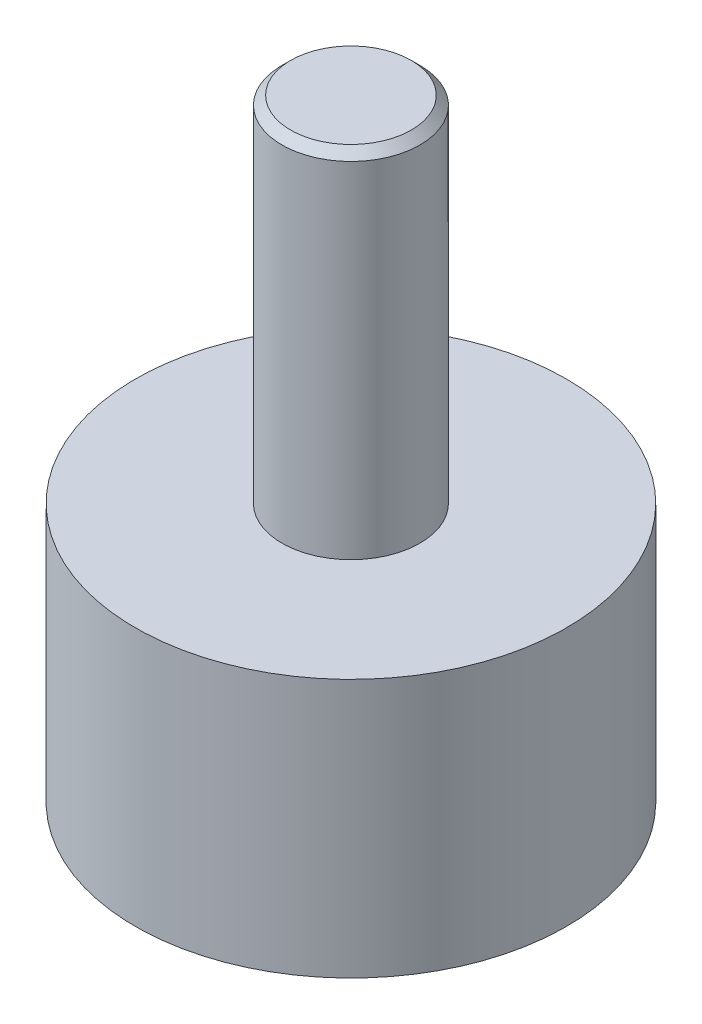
SolidWorks part; units mm, degrees
ref_plane "Plan1" through (0, 0, 0) normal (0, 0, 1) x (1, 0, 0)
ref_plane "Plan2" through (0, 0, 0) normal (0, 1, 0) x (1, 0, 0)
ref_plane "Plan3" through (0, 0, 0) normal (1, 0, 0) x (0, 0, -1)
sketch "Esquisse1" plane through (0, 0, 0) normal (0, 0, 1) x (1, 0, 0)
  line L0 (0, 0) -> (0, 60) construction
  line L1 (0, 0) -> (-12.5, 0)
  line L2 (-12.5, 0) -> (-12.5, 15)
  line L3 (-12.5, 15) -> (-4, 15)
  line L4 (-4, 15) -> (-4, 35)
  line L5 (-3.5, 35.5) -> (0, 35.5)
  line L6 (0, 0) -> (0, 35.5)
  line L7 (-3.5, 35.5) -> (-4, 35)
  dimension "D1" = 15
  dimension "D2" = 25
  dimension "D3" = 8
  dimension "D4" = 20.5
  dimension "D5" = 225
  dimension "D6" = 0.5
revolve "Base-Révolution" add sketch "Esquisse1" angle 360 about L0
